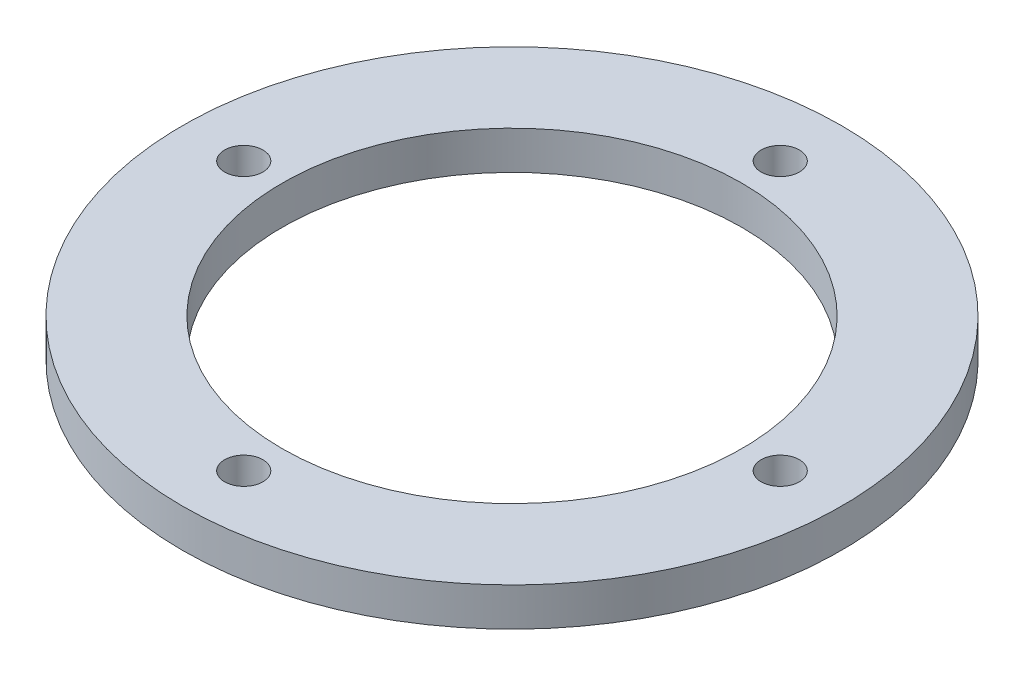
SolidWorks part; units mm, degrees
ref_plane "Front Plane" through (0, 0, 0) normal (0, 0, 1) x (1, 0, 0)
ref_plane "Top Plane" through (0, 0, 0) normal (0, 1, 0) x (1, 0, 0)
ref_plane "Right Plane" through (0, 0, 0) normal (1, 0, 0) x (0, 0, -1)
sketch "Sketch1" plane through (0, 0, 0) normal (0, 1, 0) x (1, 0, 0)
  circle A0 centre (0, 0) radius 43
  circle A1 centre (-35, 0) radius 2.5
  circle A2 centre (0, 35) radius 2.5
  circle A3 centre (35, 0) radius 2.5
  circle A4 centre (0, -35) radius 2.5
  circle A5 centre (0, 0) radius 30
  point P3 (0, 35)
  point P7 (35, 0)
  point P8 (0, -35)
  point P9 (-35, 0)
  point P10 (0, 0)
  dimension "D1" = 86
  dimension "D3" = 5
  dimension "D2" = 35
extrude "Boss-Extrude1" add sketch "Sketch1" along normal blind 5
